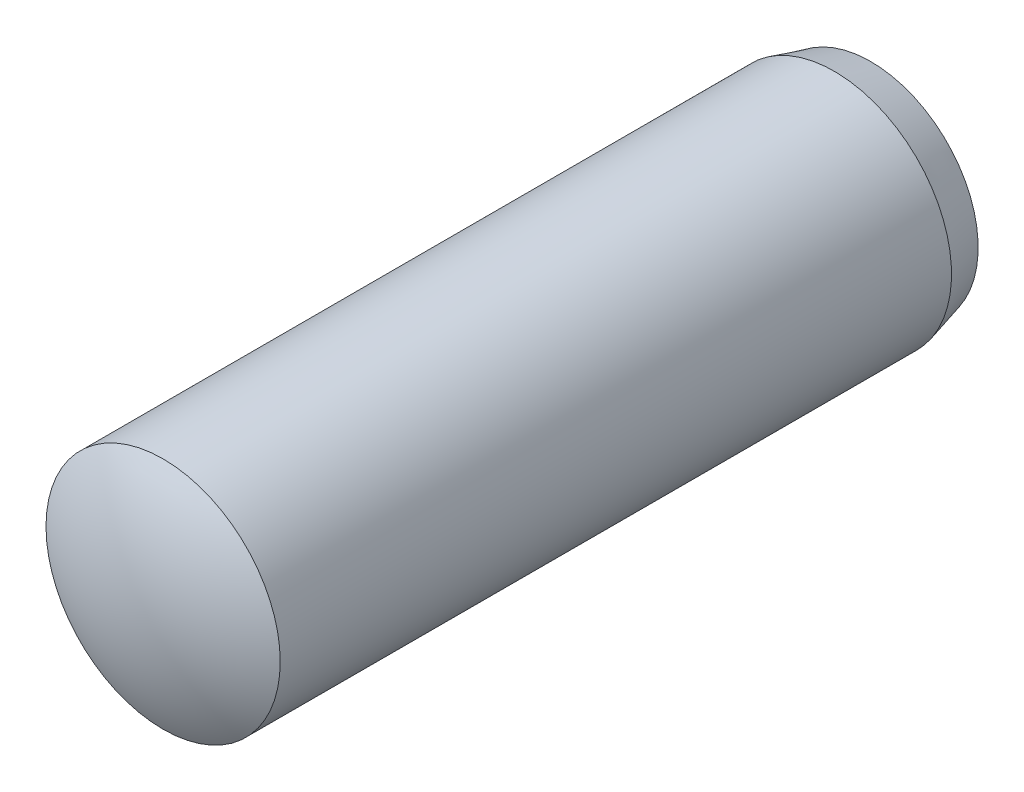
SolidWorks part; units mm, degrees
extrude "Base-Extrusion" add sketch "Esquisse2" along normal mid plane 9.8
sketch "Esquisse2" plane through (0, 0, 0) normal (0, 0, 1) x (1, 0, 0)
  circle A0 centre (0, 0) radius 1.5
  dimension "diamêtre" = 3
revolve "Enlever de la matière-Révolution1" cut sketch "Esquisse3" angle 360 about L2
sketch "Esquisse3" plane through (0, 0, 0) normal (0, 1, 0) x (1, 0, 0)
  line L0 (1.5, 4.9) -> (-1.5, 4.9) construction
  line L1 (1.5, 4.9) -> (1.2856, 4.9)
  line L2 (0, 11.7994) -> (0, -14.1244) construction
  line L4 (0, -4.9) -> (0, 4.9) construction
  line L5 (1.2856, 4.9) -> (1.5, 4.1)
  line L6 (1.5, 4.9) -> (1.5, 4.1)
  dimension "D1" = 165
  dimension "Haut-ch" = 0.8
revolve "Enlever de la matière-Révolution5" cut sketch "Esquisse6" angle 360 about L5
sketch "Esquisse6" plane through (0, 0, 0) normal (0, 1, 0) x (1, 0, 0)
  line L0 (0, -4.9) -> (0, 4.1) construction
  line L1 (-1.5, -4.9) -> (1.5, -4.9) construction
  line L3 (-1.5, 4.1) -> (-1.5, -4.9) construction
  line L5 (0, -11.8631) -> (0, -1) construction
  line L6 (-1.5, -4.4981) -> (-1.5, -7.9)
  line L7 (0, -4.9) -> (0, -7.9)
  line L8 (0, -7.9) -> (-1.5, -7.9)
  arc A0 (-1.5, -4.4981) -> (0, -4.9) centre (0, -1.9) ccw
ref_plane "FACE" through (0, 0, 0) normal (0, 0, 1) x (1, 0, 0)
ref_plane "DESSUS" through (0, 0, 0) normal (0, 1, 0) x (1, 0, 0)
ref_plane "DROITE" through (0, 0, 0) normal (1, 0, 0) x (0, 0, -1)
sketch "Esquisse5" plane through (0, 0, 0) normal (0, 1, 0) x (1, 0, 0)
  line L0 (0, -4.9) -> (0, 4.1) construction
  line L1 (0, 4.9) -> (0, 5.4)
  line L2 (0, 10.5664) -> (0, -3) construction
  line L4 (1.2856, 4.9) -> (-1.2856, 4.9) construction
  line L8 (-1.2856, 4.9) -> (-1.5, 4.1) construction
  line L9 (-1.1517, 5.4) -> (0, 5.4)
  line L10 (-1.1517, 5.4) -> (-1.3751, 4.5663)
  arc A0 (0, 4.9) -> (-1.3751, 4.5663) centre (0, 1.9) ccw
revolve "Enlever de la matière-Révolution4" cut sketch "Esquisse5" angle 360 about L2
equation "\"D1@Esquisse5\" = 2 * \"diamêtre@Esquisse2\""
equation "\"D1@Esquisse6\"=2 * \"diamêtre@Esquisse2\""
